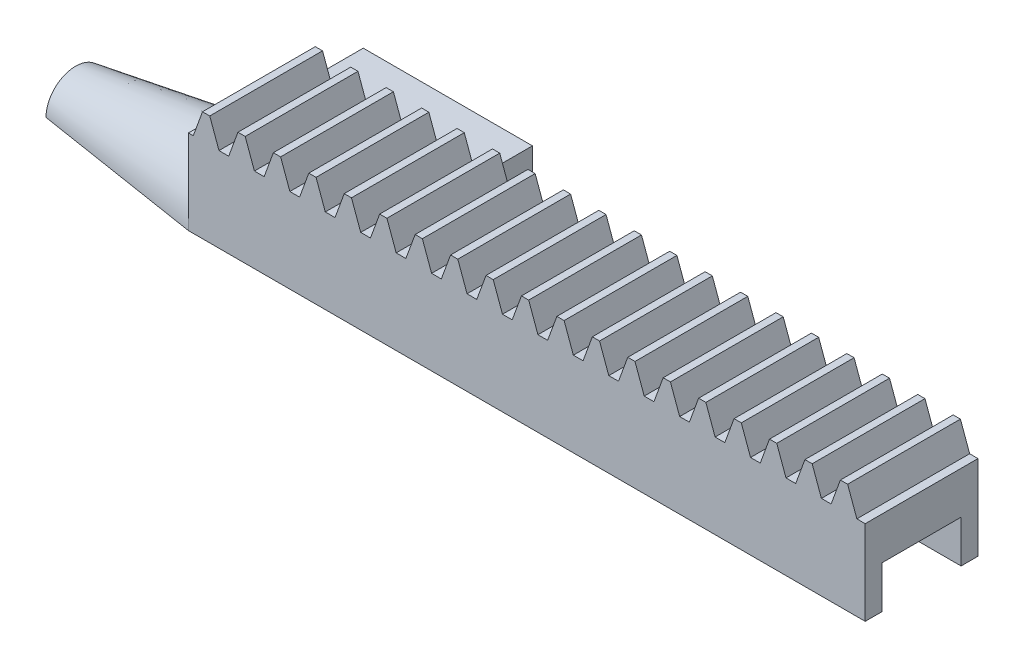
SolidWorks part; units mm, degrees
extrude "Blank" add sketch "BlankSke" against normal blind 20
sketch "BlankSke" plane through (0, 0, 0) normal (0, 0, 1) x (1, 0, 0)
  line L1 (0, 0) -> (120, 0)
  line L2 (0, 0) -> (0, 12)
  line L3 (0, 12) -> (120, 12)
  line L4 (120, 0) -> (120, 12)
ref_plane "Plane1" through (0, 0, 0) normal (0, 0, 1) x (1, 0, 0)
ref_plane "Plane2" through (0, 0, 0) normal (0, 1, 0) x (1, 0, 0)
ref_plane "Plane3" through (0, 0, 0) normal (1, 0, 0) x (0, 0, -1)
other "Configuration Table"
sketch "HoldingSke" plane through (0, 0, 0) normal (0, 1, 0) x (1, 0, 0)
  line L0 (0, 0) -> (0.0696, 0.4951)
  line L1 (-15, 0) -> (100, 0) construction
  line L2 (0, 0) -> (-2.1039, 2.3779)
  line L3 (0, 0) -> (-11.863, 4.5341)
  line L4 (0, 0) -> (8.0624, 3.0949)
  line L5 (0, 0) -> (-23.7986, -8.8762)
  line L6 (0, 0) -> (-10.5278, -7.1032)
  line L9 (-71.009, 38.7566) -> (41.7541, 79.799)
  line L10 (-76.2, 4.3779) -> (-66.2, 4.3779)
  line L11 (0, 0) -> (-10, 0)
  line L12 (-76.2, 101.6) -> (-76.133, 101.6)
  line L13 (24.9733, 27.94) -> (52.9518, 28.4284)
  line L14 (24.9733, 27.94) -> (24.9743, 27.94)
  line L15 (24.9733, 27.94) -> (100.4006, 29.5858)
  circle A0 centre (0, 0) radius 19.05
  circle A1 centre (0, 0) radius 5
  circle A2 centre (0, 0) radius 12.7
sketch "TooCutSkeIll" plane through (0, 0, 0) normal (0, 0, 1) x (1, 0, 0)
  line L0 (-2.4806, 11.9474) -> (-0.9819, 7.8296)
  line L1 (-0.5111, 7.5) -> (0.5111, 7.5)
  line L2 (0.9819, 7.8296) -> (2.4806, 11.9474)
  line L3 (120, 12) -> (0, 12) construction
  line L4 (0, 0) -> (0, 64.897) construction
  line L5 (-13.208, 10) -> (12.954, 10) construction
  line L6 (0, 0) -> (120, 0) construction
  line L7 (1.7718, 10) -> (1.7718, 48.7463) construction
  line L8 (-1.7718, 10) -> (-1.7718, 48.7463) construction
  line L9 (2.5558, 12) -> (2.5558, 12.0254)
  line L10 (-2.5558, 12) -> (-2.5558, 12.0254)
  line L11 (-2.5558, 12.0254) -> (2.5558, 12.0254)
  arc A0 (0.5111, 7.5) -> (0.9819, 7.8296) centre (0.5111, 8.001) ccw
  arc A1 (-0.9819, 7.8296) -> (-0.5111, 7.5) centre (-0.5111, 8.001) ccw
  arc A2 (2.5558, 12) -> (2.4806, 11.9474) centre (2.5558, 11.92) ccw
  arc A3 (-2.4806, 11.9474) -> (-2.5558, 12) centre (-2.5558, 11.92) ccw
extrude "ToothCutIll" [suppressed] cut sketch "TooCutSkeIll" against normal through all
sketch "TooCutSkeSim" plane through (0, 0, 0) normal (0, 0, 1) x (1, 0, 0)
  line L0 (0.8619, 7.5) -> (-0.8619, 7.5)
  line L1 (2.509, 12.0254) -> (0.8619, 7.5)
  line L2 (0, 17.4625) -> (0, 53.467) construction
  line L3 (2.509, 12.0254) -> (-2.509, 12.0254)
  line L6 (-2.509, 12.0254) -> (-0.8619, 7.5)
  line L9 (-1.7718, 10) -> (1.7718, 10) construction
  line L10 (0, 0) -> (120, 0) construction
  line L11 (1.7718, 10) -> (1.7718, 53.467) construction
  line L12 (-1.7718, 10) -> (-1.7718, 53.467) construction
extrude "ToothCutSim" cut sketch "TooCutSkeSim" against normal through all
pattern_linear "TeethCuts" count 20 spacing 6.2832 along (1, 0, 0) of "ToothCutIll", "ToothCutSim"
sketch "草图1" plane through (0, 0, 0) normal (0, -1, 0) x (1, 0, 0)
  line L0 (120, -20) -> (0, -20)
  line L1 (0, -20) -> (0, -17)
  line L2 (0, -20) -> (0, 0) construction
  line L3 (0, -17) -> (120, -17)
  line L4 (120, -20) -> (120, 0) construction
  line L5 (120, -17) -> (120, -20)
  line L6 (120, -10) -> (0, -10) construction
  line L7 (0, -3) -> (120, -3)
  line L8 (0, 0) -> (0, -3)
  line L9 (120, 0) -> (0, 0)
  line L10 (120, -3) -> (120, 0)
  dimension "D1" = 3
extrude "凸台-拉伸1" add sketch "草图1" along normal blind 7.5
sketch "草图3" plane through (0, 0, 0) normal (-1, 0, 0) x (0, 0, 1)
  line L0 (0, -7.5) -> (-29.3324, -7.5) construction
  line L1 (-10, 12) -> (-10, -30.8459) construction
  line L2 (0, 12) -> (-20, 12) construction
  line L3 (-20, -7.5) -> (0, -7.5) construction
  line L5 (-20, -7.5) -> (0, -7.5)
  arc A1 (0, -7.5) -> (-20, -7.5) centre (-10, -7.5) ccw
sketch "草图5" plane through (0, 0, 0) normal (-1, 0, 0) x (0, 0, 1)
  line L0 (-20, 0.0192) -> (-20, 5.0192)
  line L3 (-20, 5.0192) -> (-31, 5.0192)
  line L4 (-31, 0.0192) -> (-31, 8.5192) construction
  line L5 (-20, 0.0192) -> (-24, 0.0192) construction
  line L6 (-31, 5.0192) -> (-31, -3.4808)
  line L7 (-31, -3.4808) -> (-24, -3.4808)
  line L8 (-24, -3.4808) -> (-24, 0.0192)
  line L9 (-24, 0.0192) -> (-20, 0.0192)
  dimension "D1" = 5
extrude "凸台-拉伸3" add sketch "草图5" against normal blind 30
sketch "草图6" plane through (0, 0, 0) normal (-1, 0, 0) x (0, 0, 1)
  line L0 (-17, -7.5) -> (-3, -7.5) construction
  circle A0 centre (-10, -7.5) radius 10
  dimension "D1" = 20
extrude "凸台-拉伸4" add sketch "草图6" along normal blind 30 draft 9
sketch "草图7" plane through (-30, 0, 0) normal (-1, 0, 0) x (0, 0, 1)
  line L1 (-10, -7.5) -> (-25.9048, -7.5) construction
  line L2 (-25.0468, -7.5) -> (-14.04, -25.2607)
  line L3 (-14.04, -25.2607) -> (5.0148, -25.2607)
  line L4 (5.0148, -25.2607) -> (6.9084, -7.5)
  line L5 (6.9084, -7.5) -> (-25.0468, -7.5)
extrude "切除-拉伸1" cut sketch "草图7" against normal up to surface (30 mm away)
sketch "草图9" plane through (-30, 0, 0) normal (-1, 0, 0) x (0, 0, 1)
  line L0 (-4.7515, -7.5) -> (-15.2485, -7.5) construction
  circle A0 centre (-10, -7.5) radius 3.5
  dimension "D1" = 7
extrude "切除-拉伸2" cut sketch "草图9" against normal up to surface (30 mm away) draft 5
equation "' \"Module@HoldingSke\" = 6.35"
equation "' \"Num_teeth@HoldingSke\" = 12"
equation "' \"Ap@HoldingSke\" =  20"
equation "' \"Ap@HoldingSke\" = 20"
equation "' \"Width@HoldingSke\" = 0.25 * 25.4"
equation "' \"Show_teeth@HoldingSke\" = 500"
equation "' \"Backlash@HoldingSke\" = 0.009 * 25.4"
equation "' \"Addendum_fac@HoldingSke\" = 1.0"
equation "' \"Dedendum_fac@HoldingSke\" = 1.25"
equation "' \"Dedendum_add@HoldingSke\" = 0.00005 * 25.4"
equation "' \"Clearance_fac@HoldingSke\" = 0.25"
equation "' \"Pitch_height@HoldingSke\" = 1 * 25.4"
equation "' \"Length@HoldingSke\" = 4.71 * 25.4"
equation "\"Pitch@HoldingSke\" = 1 / \"Module@HoldingSke\""
equation "\"MPH@HoldingSke\" = \"Dedendum_fac@HoldingSke\" / \"Pitch@HoldingSke\" + 2 * \"Dedendum_add@HoldingSke\" + 0.002 * 25.4"
equation "\"MPH@HoldingSke\" = ((sgn( \"MPH@HoldingSke\" - \"Pitch_height@HoldingSke\")+1)*( \"MPH@HoldingSke\" - \"Pitch_height@HoldingSke\"))/2 + \"Pitch_height@HoldingSke\""
equation "\"Blank_height@BlankSke\" = \"Pitch_height@HoldingSke\" + \"Addendum_fac@HoldingSke\"  / \"Pitch@HoldingSke\" "
equation "\"Length@BlankSke\" =  \"Length@HoldingSke\""
equation "\"Pressure_angle@TooCutSkeIll\" = \"Ap@HoldingSke\""
equation "\"Addendum_plus@TooCutSkeIll\" =  \"Addendum_fac@HoldingSke\"  / \"Pitch@HoldingSke\" + 0.001 *25.4"
equation "\"Dedendum@TooCutSkeIll\" = \"Dedendum_fac@HoldingSke\"  / \"Pitch@HoldingSke\""
equation "\"Pitch_height@TooCutSkeIll\" =  \"MPH@HoldingSke\""
equation "\"Gap_width@TooCutSkeIll\" = 3.14159265 / 2 / \"Pitch@HoldingSke\" + 6 * \"Backlash@HoldingSke\""
equation "\"Pressure_angle@TooCutSkeSim\" = \"Ap@HoldingSke\""
equation "\"Addendum_plus@TooCutSkeSim\" =  \"Addendum_fac@HoldingSke\"  / \"Pitch@HoldingSke\" + 0.001 * 25.4"
equation "\"Dedendum@TooCutSkeSim\" = \"Dedendum_fac@HoldingSke\"  / \"Pitch@HoldingSke\""
equation "\"Pitch_height@TooCutSkeSim\" =  \"MPH@HoldingSke\""
equation "\"Gap_width@TooCutSkeSim\" = 3.14159265 / 2 / \"Pitch@HoldingSke\" + 6 * \"Backlash@HoldingSke\""
equation "\"Root_fillet@TooCutSkeIll\" = \"Clearance_fac@HoldingSke\" / \"Pitch@HoldingSke\" + \"Dedendum_add@HoldingSke\""
equation "\"Break_rad@TooCutSkeIll\" = 0.02 / \"Pitch@HoldingSke\" * 2"
equation "\"Linear_pitch@TeethCuts\" = 3.14159265 / \"Pitch@HoldingSke\""
equation "\"Num_teeth@HoldingSke\" = int( ( \"Length@HoldingSke\" + 0 ) / (3.14159265 / \"Pitch@HoldingSke\")) + 0.9999  + 1"
equation " \"Num_teeth@TeethCuts\" = int( \"Show_teeth@HoldingSke\" ) + 1"
equation " \"Num_teeth@TeethCuts\" = ((sgn( \"Num_teeth@TeethCuts\" - \"Num_teeth@HoldingSke\" )-1)*( \"Num_teeth@TeethCuts\" - \"Num_teeth@HoldingSke\" ))/-2+ \"Num_teeth@HoldingSke\""
equation " \"Num_teeth@TeethCuts\" = ((sgn( \"Num_teeth@TeethCuts\" - 2.0)+1)*( \"Num_teeth@TeethCuts\" - 2.0))/2 +2.0"
